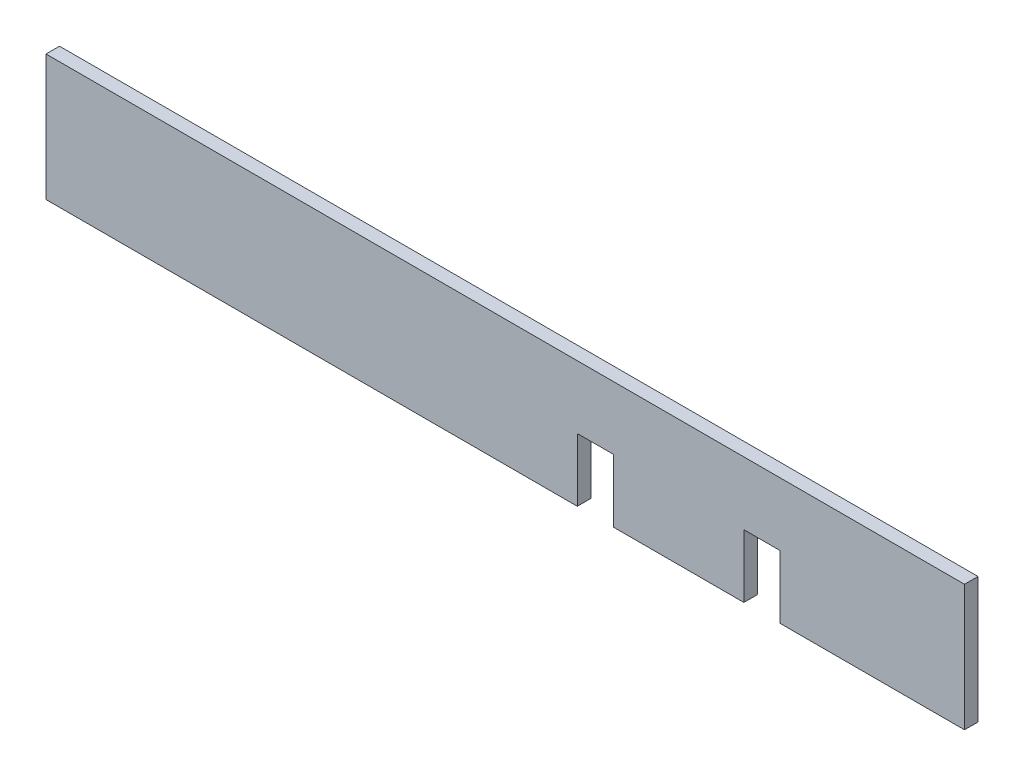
SolidWorks part; units mm, degrees
ref_plane "Plan de face" through (0, 0, 0) normal (0, 0, 1) x (1, 0, 0)
ref_plane "Plan de dessus" through (0, 0, 0) normal (0, 1, 0) x (1, 0, 0)
ref_plane "Plan de droite" through (0, 0, 0) normal (1, 0, 0) x (0, 0, -1)
sketch "Esquisse1" plane through (0, 0, 0) normal (0, 0, 1) x (1, 0, 0)
  line L0 (0, 0) -> (0, 140)
  line L1 (0, 140) -> (1020, 140)
  line L2 (1020, 140) -> (1020, 0)
  line L3 (1020, 0) -> (815, 0)
  line L4 (815, 0) -> (815, 70)
  line L5 (815, 70) -> (775, 70)
  line L6 (775, 70) -> (775, 0)
  line L7 (775, 0) -> (630, 0)
  line L8 (630, 0) -> (630, 70)
  line L9 (630, 70) -> (590, 70)
  line L10 (590, 70) -> (590, 0)
  line L11 (590, 0) -> (0, 0)
  dimension "D1" = 40
  dimension "D2" = 40
  dimension "D3" = 70
  dimension "D4" = 1020
  dimension "D5" = 140
  dimension "D6" = 205
  dimension "D7" = 145
extrude "Extrusion1" add sketch "Esquisse1" along normal blind 15
